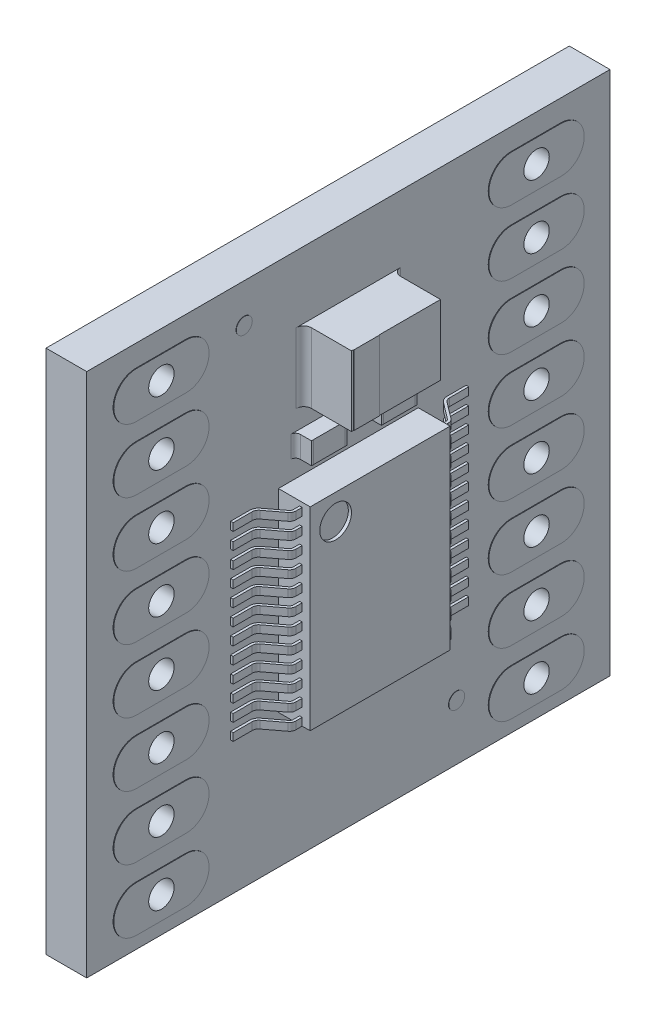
SolidWorks part; units mm, degrees
ref_plane "Front Plane" through (0, 0, 0) normal (0, 0, 1) x (1, 0, 0)
ref_plane "Top Plane" through (0, 0, 0) normal (0, 1, 0) x (1, 0, 0)
ref_plane "Right Plane" through (0, 0, 0) normal (1, 0, 0) x (0, 0, -1)
sketch "Sketch1" plane through (0, 0, 0) normal (1, 0, 0) x (0, 0, -1)
  line L1 (-10.4521, 10.4902) -> (10.4521, 10.4902)
  line L2 (-10.4521, 10.4902) -> (-10.4521, -10.4902)
  line L3 (-10.4521, -10.4902) -> (10.4521, -10.4902)
  line L4 (10.4521, 10.4902) -> (10.4521, -10.4902)
  line L5 (-10.4521, 10.4902) -> (10.4521, -10.4902) construction
  line L6 (-10.4521, -10.4902) -> (10.4521, 10.4902) construction
  point P0 (0, 0)
  dimension "D1" = 20.9804
  dimension "D2" = 20.9042
extrude "Boss-Extrude1" add sketch "Sketch1" along normal blind 1.6256
sketch "Sketch2" plane through (1.6256, 0, 0) normal (1, 0, 0) x (0, 0, -1)
  line L0 (-10.4521, -10.4902) -> (10.4521, -10.4902) construction
  line L1 (-2.794, 2.6162) -> (2.794, 2.6162)
  line L2 (-2.794, 2.6162) -> (-2.794, -5.1308)
  line L3 (-2.794, -5.1308) -> (2.794, -5.1308)
  line L4 (2.794, 2.6162) -> (2.794, -5.1308)
  line L5 (-2.794, 2.6162) -> (2.794, -5.1308) construction
  line L6 (-2.794, -5.1308) -> (2.794, 2.6162) construction
  point P0 (0, 0)
  dimension "D1" = 5.588
  dimension "D2" = 7.747
  dimension "D3" = 5.3594
extrude "Boss-Extrude2" add sketch "Sketch2" along normal blind 1.27
sketch "Sketch7" plane through (2.8956, 0, 0) normal (1, 0, 0) x (0, 0, -1)
  line L0 (-2.794, 2.6162) -> (-2.794, -5.1308) construction
  line L1 (2.794, 2.6162) -> (-2.794, 2.6162) construction
  circle A0 centre (-1.778, 1.6002) radius 0.635
  dimension "D1" = 1.27
  dimension "D2" = 1.016
  dimension "D3" = 1.016
extrude "Cut-Extrude2" cut sketch "Sketch7" against normal blind 0.127
sketch "Sketch4" plane through (1.6256, 0, 0) normal (1, 0, 0) x (0, 0, -1)
  line L0 (-7.493, 8.7122) -> (0, 8.7122) construction
  line L1 (0, 8.7122) -> (7.493, 8.7122) construction
  line L2 (0, 0) -> (0, 8.7122) construction
  line L3 (10.4521, 10.4902) -> (-10.4521, 10.4902) construction
  circle A0 centre (-7.493, 8.7122) radius 0.508
  circle A1 centre (7.493, 8.7122) radius 0.508
  dimension "D2" = 1.016
  dimension "D1" = 14.986
  dimension "D3" = 1.27
extrude "Cut-Extrude1" cut sketch "Sketch4" against normal through all
sketch "Sketch5" plane through (1.6256, 0, 0) normal (1, 0, 0) x (0, 0, -1)
  line L0 (-8.4836, 8.7122) -> (-6.5024, 8.7122) construction
  line L1 (-8.4836, 9.6266) -> (-6.5024, 9.6266)
  line L2 (-8.4836, 7.7978) -> (-6.5024, 7.7978)
  line L3 (6.5024, 8.7122) -> (8.4836, 8.7122) construction
  line L4 (6.5024, 9.6266) -> (8.4836, 9.6266)
  line L5 (6.5024, 7.7978) -> (8.4836, 7.7978)
  arc A0 (-8.4836, 9.6266) -> (-8.4836, 7.7978) centre (-8.4836, 8.7122) ccw
  arc A1 (-6.5024, 7.7978) -> (-6.5024, 9.6266) centre (-6.5024, 8.7122) ccw
  arc A2 (6.5024, 9.6266) -> (6.5024, 7.7978) centre (6.5024, 8.7122) ccw
  arc A3 (8.4836, 7.7978) -> (8.4836, 9.6266) centre (8.4836, 8.7122) ccw
  circle A6 centre (7.493, 8.7122) radius 0.508 construction
  circle A7 centre (-7.493, 8.7122) radius 0.508 construction
  circle A8 centre (7.493, 8.7122) radius 0.508
  circle A9 centre (-7.493, 8.7122) radius 0.508
  point P3 (-7.493, 8.7122)
  point P8 (7.493, 8.7122)
  point P18 (7.493, 8.7122)
  dimension "D2" = 3.81
  dimension "D1" = 1.8288
extrude "Boss-Extrude3" add sketch "Sketch5" along normal blind 0.0254
sketch "Sketch6" plane through (0, 0, 0) normal (-1, 0, 0) x (0, 0, 1)
  line L0 (-6.5024, 7.7978) -> (-8.4836, 7.7978) construction
  line L1 (-8.4836, 9.6266) -> (-6.5024, 9.6266) construction
  line L2 (8.4836, 7.7978) -> (6.5024, 7.7978) construction
  line L3 (6.5024, 9.6266) -> (8.4836, 9.6266) construction
  line L4 (-6.5024, 7.7978) -> (-8.4836, 7.7978)
  line L5 (-8.4836, 9.6266) -> (-6.5024, 9.6266)
  line L6 (8.4836, 7.7978) -> (6.5024, 7.7978)
  line L7 (6.5024, 9.6266) -> (8.4836, 9.6266)
  circle A0 centre (-7.493, 8.7122) radius 0.508 construction
  arc A1 (-6.5024, 7.7978) -> (-6.5024, 9.6266) centre (-6.5024, 8.7122) ccw construction
  arc A2 (-8.4836, 9.6266) -> (-8.4836, 7.7978) centre (-8.4836, 8.7122) ccw construction
  circle A3 centre (7.493, 8.7122) radius 0.508 construction
  arc A4 (6.5024, 9.6266) -> (6.5024, 7.7978) centre (6.5024, 8.7122) ccw construction
  arc A5 (8.4836, 7.7978) -> (8.4836, 9.6266) centre (8.4836, 8.7122) ccw construction
  circle A6 centre (-7.493, 8.7122) radius 0.508
  arc A7 (-6.5024, 7.7978) -> (-6.5024, 9.6266) centre (-6.5024, 8.7122) ccw
  arc A8 (-8.4836, 9.6266) -> (-8.4836, 7.7978) centre (-8.4836, 8.7122) ccw
  circle A9 centre (7.493, 8.7122) radius 0.508
  arc A10 (6.5024, 9.6266) -> (6.5024, 7.7978) centre (6.5024, 8.7122) ccw
  arc A11 (8.4836, 7.7978) -> (8.4836, 9.6266) centre (8.4836, 8.7122) ccw
extrude "Boss-Extrude4" add sketch "Sketch6" along normal blind 0.0254
pattern_linear "LPattern1" count 8 spacing 2.54 along (0, -1, 0) of "Cut-Extrude1", "Boss-Extrude3", "Boss-Extrude4"
sketch "Sketch11" plane through (1.6256, 0, 0) normal (1, 0, 0) x (0, 0, -1)
  circle A0 centre (-4.1683, 8.9453) radius 0.3175
  circle A1 centre (4.3185, -8.2635) radius 0.3175
  dimension "D1" = 0.635
extrude "Boss-Extrude8" add sketch "Sketch11" along normal blind 0.0127
sketch "Sketch9" plane through (1.6256, 0, 0) normal (1, 0, 0) x (0, 0, -1)
  line L0 (-1.397, 3.81) -> (0, 3.81) construction
  line L1 (-2.032, 4.2418) -> (-0.762, 4.2418)
  line L2 (-2.032, 4.2418) -> (-2.032, 3.3782)
  line L3 (-2.032, 3.3782) -> (-0.762, 3.3782)
  line L4 (-0.762, 4.2418) -> (-0.762, 3.3782)
  line L5 (-2.032, 4.2418) -> (-0.762, 3.3782) construction
  line L6 (-2.032, 3.3782) -> (-0.762, 4.2418) construction
  line L7 (0.762, 4.2418) -> (2.032, 4.2418)
  line L8 (0.762, 4.2418) -> (0.762, 3.3782)
  line L9 (0.762, 3.3782) -> (2.032, 3.3782)
  line L10 (2.032, 4.2418) -> (2.032, 3.3782)
  line L11 (0.762, 4.2418) -> (2.032, 3.3782) construction
  line L12 (0.762, 3.3782) -> (2.032, 4.2418) construction
  line L13 (0, 3.81) -> (1.397, 3.81) construction
  line L14 (0, 3.81) -> (0, 0) construction
  line L15 (2.794, 2.6162) -> (-2.794, 2.6162) construction
  point P0 (-1.397, 3.81)
  point P5 (1.397, 3.81)
  dimension "D1" = 0.8636
  dimension "D2" = 1.27
  dimension "D3" = 1.397
  dimension "D4" = 0.762
extrude "Boss-Extrude6" add sketch "Sketch9" along normal blind 0.635
sketch "Sketch10" plane through (1.6256, 0, 0) normal (1, 0, 0) x (0, 0, -1)
  line L1 (-0.762, 4.2418) -> (-0.6858, 4.2418)
  line L2 (-0.762, 4.2418) -> (-0.762, 3.3782)
  line L3 (-0.762, 3.3782) -> (-0.6858, 3.3782)
  line L4 (-0.6858, 4.2418) -> (-0.6858, 3.3782)
  line L5 (-2.032, 4.2418) -> (-2.1082, 4.2418)
  line L6 (-2.032, 4.2418) -> (-2.032, 3.3782)
  line L7 (-2.032, 3.3782) -> (-2.1082, 3.3782)
  line L8 (-2.1082, 4.2418) -> (-2.1082, 3.3782)
  line L9 (0.762, 4.2418) -> (0.6858, 4.2418)
  line L10 (0.762, 4.2418) -> (0.762, 3.3782)
  line L11 (0.762, 3.3782) -> (0.6858, 3.3782)
  line L12 (0.6858, 4.2418) -> (0.6858, 3.3782)
  line L13 (2.032, 4.2418) -> (2.1082, 4.2418)
  line L14 (2.032, 4.2418) -> (2.032, 3.3782)
  line L15 (2.032, 3.3782) -> (2.1082, 3.3782)
  line L16 (2.1082, 4.2418) -> (2.1082, 3.3782)
  line L17 (-2.032, 3.3782) -> (-0.762, 3.3782) construction
  dimension "D1" = 0.0762
extrude "Boss-Extrude7" add sketch "Sketch10" along normal blind 0.6363
fillet "Fillet1" radius 0.1905 4 edges at (1.6256, 3.81, -2.1082) (1.6256, 3.81, -0.6858) (1.6256, 3.81, 0.6858) (1.6256, 3.81, 2.1082)
sketch "Sketch12" plane through (1.6256, 0, 0) normal (1, 0, 0) x (0, 0, -1)
  line L0 (0, 0) -> (0, 6.4262) construction
  line L1 (-1.778, 5.0292) -> (1.778, 5.0292)
  line L2 (-1.778, 5.0292) -> (-1.778, 7.8232)
  line L3 (-1.778, 7.8232) -> (1.778, 7.8232)
  line L4 (1.778, 5.0292) -> (1.778, 7.8232)
  line L5 (-1.778, 5.0292) -> (1.778, 7.8232) construction
  line L6 (-1.778, 7.8232) -> (1.778, 5.0292) construction
  line L8 (10.4521, 10.4902) -> (-10.4521, 10.4902) construction
  point P0 (0, 6.4262)
  dimension "D1" = 2.794
  dimension "D2" = 3.556
  dimension "D3" = 2.667
extrude "Boss-Extrude9" add sketch "Sketch12" along normal blind 1.905
fillet "Fillet2" radius 0.3048 2 edges at (1.6256, 6.4262, -1.778) (1.6256, 6.4262, 1.778)
sketch "Sketch13" plane through (3.5306, 0, 0) normal (1, 0, 0) x (0, 0, -1)
  line L0 (1.778, 7.8232) -> (-1.778, 7.8232) construction
  line L1 (-1.6958, 7.8232) -> (-0.6798, 7.8232)
  line L2 (-1.6958, 7.8232) -> (-1.6958, 5.0292)
  line L3 (-1.6958, 5.0292) -> (-0.6798, 5.0292)
  line L4 (-0.6798, 7.8232) -> (-0.6798, 5.0292)
  line L5 (-2.0828, 5.0292) -> (2.0828, 5.0292) construction
  dimension "D1" = 1.016
extrude "Boss-Extrude10" add sketch "Sketch13" along normal blind 0.0127
sketch "Sketch14" plane through (0, -5.1308, 0) normal (0, -1, 0) x (1, 0, 0)
  line L0 (2.5745, -2.794) -> (2.5745, -3.048)
  line L1 (2.8956, -2.794) -> (1.6256, -2.794) construction
  line L2 (2.4739, -3.2504) -> (1.8278, -3.74)
  line L3 (1.7272, -3.9425) -> (1.7272, -4.7045)
  line L4 (2.4729, -2.794) -> (2.4729, -3.048)
  line L5 (2.4126, -3.1695) -> (1.7664, -3.659)
  line L6 (1.6256, -3.9425) -> (1.6256, -4.7045)
  line L7 (2.5745, -2.794) -> (2.4729, -2.794)
  line L8 (1.7272, -4.7045) -> (1.6256, -4.7045)
  line L9 (1.6256, 10.4521) -> (1.6256, -10.4521) construction
  line L10 (2.8956, 0) -> (-1.1531, 0) construction
  line L11 (2.8956, 2.794) -> (2.8956, -2.794) construction
  line L12 (2.5745, 2.794) -> (2.4729, 2.794)
  line L13 (2.5745, 2.794) -> (2.5745, 3.048)
  line L14 (2.4729, 2.794) -> (2.4729, 3.048)
  line L15 (2.4739, 3.2504) -> (1.8278, 3.74)
  line L16 (2.4126, 3.1695) -> (1.7664, 3.659)
  line L17 (1.7272, 3.9425) -> (1.7272, 4.7045)
  line L18 (1.7272, 4.7045) -> (1.6256, 4.7045)
  line L19 (1.6256, 3.9425) -> (1.6256, 4.7045)
  arc A0 (1.8278, -3.74) -> (1.7272, -3.9425) centre (1.9812, -3.9425) ccw
  arc A1 (2.5745, -3.048) -> (2.4739, -3.2504) centre (2.3205, -3.048) cw
  arc A2 (2.4729, -3.048) -> (2.4126, -3.1695) centre (2.3205, -3.048) cw
  arc A3 (1.7664, -3.659) -> (1.6256, -3.9425) centre (1.9812, -3.9425) ccw
  arc A4 (2.4729, 3.048) -> (2.4126, 3.1695) centre (2.3205, 3.048) ccw
  arc A5 (2.5745, 3.048) -> (2.4739, 3.2504) centre (2.3205, 3.048) ccw
  arc A6 (1.7664, 3.659) -> (1.6256, 3.9425) centre (1.9812, 3.9425) cw
  arc A7 (1.8278, 3.74) -> (1.7272, 3.9425) centre (1.9812, 3.9425) cw
  dimension "D1" = 0.254
  dimension "D3" = 232.848
  dimension "D4" = 0.254
  dimension "D5" = 0.762
  dimension "D2" = 0.1016
extrude "Boss-Extrude11" add sketch "Sketch14" against normal blind 0.3048
pattern_linear "LPattern2" count 12 spacing 0.6604 along (0, 1, 0) of "Boss-Extrude11"
